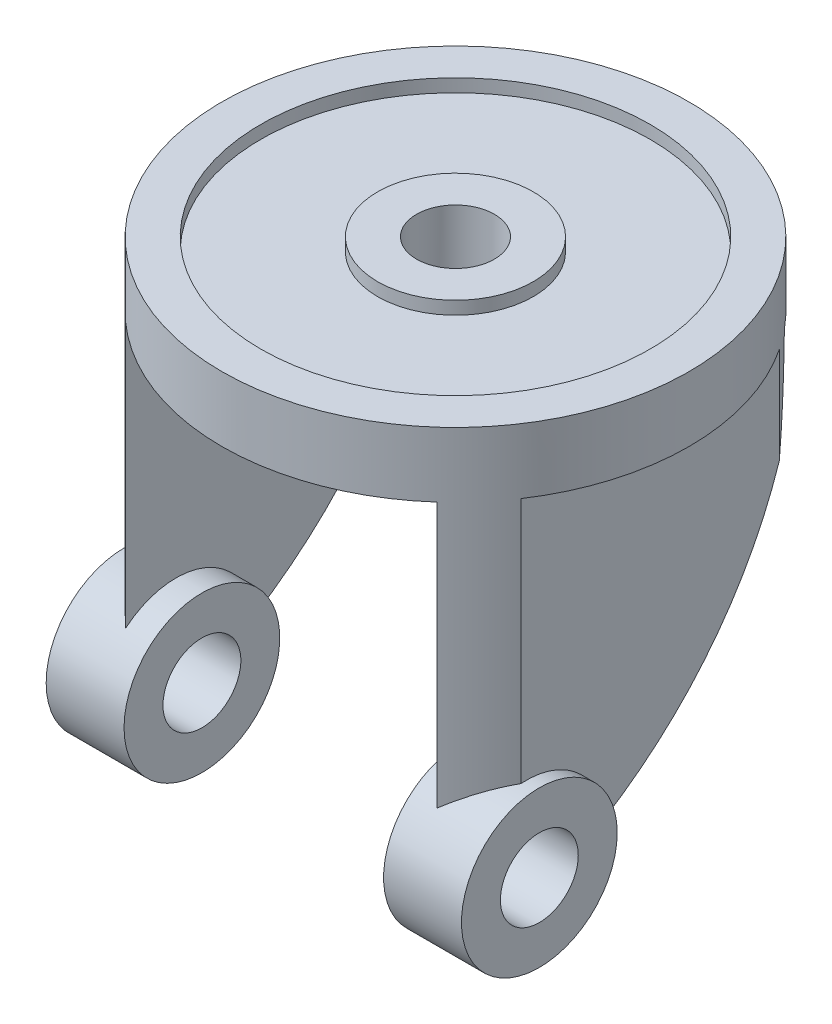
SolidWorks part; units mm, degrees
ref_plane "Front" through (0, 0, 0) normal (0, 0, 1) x (1, 0, 0)
ref_plane "Top" through (0, 0, 0) normal (0, 1, 0) x (1, 0, 0)
ref_plane "Right" through (0, 0, 0) normal (1, 0, 0) x (0, 0, -1)
sketch "Sketch1" plane through (0, 0, 0) normal (1, 0, 0) x (0, 0, -1)
  circle A0 centre (0, 0) radius 18
  circle A1 centre (0, 0) radius 9
  dimension "D1" = 18
  dimension "D2" = 36
extrude "Boss-Extrude1" add sketch "Sketch1" along normal mid plane 96
ref_plane "Plane1" through (0, 90, 0) normal (0, 1, 0) x (-1, 0, 0)
sketch "Sketch2" plane through (0, 90, 0) normal (0, 1, 0) x (-1, 0, 0)
  circle A0 centre (0, -28.6156) radius 54
  dimension "D1" = 108
extrude "Boss-Extrude2" add sketch "Sketch2" against normal blind 15 separate body
ref_plane "Plane2" through (45, 0, 0) normal (1, 0, 0) x (0, 0, -1)
sketch "Sketch3" plane through (45, 0, 0) normal (1, 0, 0) x (0, 0, -1)
  line L0 (-18, 0) -> (-18, 75)
  line L1 (-25.3844, 75) -> (82.6156, 75) construction
  line L2 (0, 0) -> (0, 75) construction
  line L3 (-18, 75) -> (30, 75)
  line L4 (30, 75) -> (63, 75)
  circle A0 centre (0, 0) radius 18 construction
  arc A1 (17.9555, 1.2643) -> (63, 75) centre (-32.6806, 82.8239) ccw
  arc A2 (17.9555, 1.2643) -> (-18, 0) centre (0, 0) ccw
  dimension "D3" = 192
  dimension "D1" = 30
  dimension "D2" = 33
extrude "Boss-Extrude3" add sketch "Sketch3" against normal blind 9
mirror "Mirror1" about plane through (0, 0, 0) normal (1, 0, 0) of "Boss-Extrude3"
sketch "Sketch4" plane through (0, 90, 0) normal (0, 1, 0) x (1, 0, 0)
  line L2 (-41.6379, 63) -> (-45, 63)
  line L3 (-45, 63) -> (-45, 58.4652)
  line L4 (-41.6379, 63) -> (-45, 63)
  line L5 (-45, 63) -> (-45, 58.4652)
  line L6 (45, 58.4652) -> (45, 63)
  line L7 (45, 63) -> (41.6379, 63)
  line L8 (45, 58.4652) -> (45, 63)
  line L9 (45, 63) -> (41.6379, 63)
  circle A0 centre (0, 28.6156) radius 54
  arc A2 (-41.6379, 63) -> (-45, 58.4652) centre (0, 28.6156) ccw
  arc A3 (-41.6379, 63) -> (-45, 58.4652) centre (0, 28.6156) ccw
  arc A4 (45, 58.4652) -> (41.6379, 63) centre (0, 28.6156) ccw
  arc A5 (45, 58.4652) -> (41.6379, 63) centre (0, 28.6156) ccw
  dimension "D1" = 108
  dimension "D2" = 0
  dimension "D3" = 0
extrude "Cut-Extrude1" cut sketch "Sketch4" against normal up to next contours L4 L5 M1 | L8 L9 M1
sketch "Sketch5" plane through (0, 75, 0) normal (0, 1, 0) x (1, 0, 0)
  line L3 (36, -11.6336) -> (36, -18)
  line L4 (36, -18) -> (45, -18)
  line L5 (45, -18) -> (45, -1.234)
  line L6 (36, -11.6336) -> (36, -18)
  line L7 (36, -18) -> (45, -18)
  line L8 (45, -18) -> (45, -1.234)
  line L9 (-45, -1.234) -> (-45, -18)
  line L10 (-45, -18) -> (-36, -18)
  line L11 (-36, -18) -> (-36, -11.6336)
  line L12 (-45, -1.234) -> (-45, -18)
  line L13 (-45, -18) -> (-36, -18)
  line L14 (-36, -18) -> (-36, -11.6336)
  arc A1 (36, -11.6336) -> (45, -1.234) centre (0, 28.6156) ccw
  arc A2 (36, -11.6336) -> (45, -1.234) centre (0, 28.6156) ccw
  arc A3 (-45, -1.234) -> (-36, -11.6336) centre (0, 28.6156) ccw
  arc A4 (-45, -1.234) -> (-36, -11.6336) centre (0, 28.6156) ccw
  dimension "D1" = 0
  dimension "D2" = 0
extrude "Cut-Extrude2" cut sketch "Sketch5" against normal up to surface (88.7353 mm away)
sketch "Sketch6" plane through (-45, 0, 0) normal (1, 0, 0) x (0, 0, -1)
  line L2 (-1.234, -17.9577) -> (-1.234, -8.915)
  line L3 (-1.234, 8.915) -> (-1.234, 17.9577)
  line L4 (-1.234, -17.9577) -> (-1.234, -8.915)
  line L5 (-1.234, 8.915) -> (-1.234, 17.9577)
  arc A2 (-1.234, 17.9577) -> (-1.234, -17.9577) centre (0, 0) ccw
  arc A3 (-1.234, 8.915) -> (-1.234, -8.915) centre (0, 0) ccw
  arc A4 (-1.234, 17.9577) -> (-1.234, -17.9577) centre (0, 0) ccw
  arc A5 (-1.234, 8.915) -> (-1.234, -8.915) centre (0, 0) ccw
  dimension "D1" = 0
extrude "Boss-Extrude4" add sketch "Sketch6" along normal up to next
sketch "Sketch7" plane through (45, 0, 0) normal (-1, 0, 0) x (0, 0, 1)
  line L2 (1.234, 17.9577) -> (1.234, 8.915)
  line L3 (1.234, -8.915) -> (1.234, -17.9577)
  line L4 (1.234, 17.9577) -> (1.234, 8.915)
  line L5 (1.234, -8.915) -> (1.234, -17.9577)
  arc A2 (1.234, -8.915) -> (1.234, 8.915) centre (0, 0) ccw
  arc A3 (1.234, -17.9577) -> (1.234, 17.9577) centre (0, 0) ccw
  arc A4 (1.234, -8.915) -> (1.234, 8.915) centre (0, 0) ccw
  arc A5 (1.234, -17.9577) -> (1.234, 17.9577) centre (0, 0) ccw
  dimension "D1" = 0
extrude "Boss-Extrude5" add sketch "Sketch7" along normal up to next
sketch "Sketch8" plane through (0, 0, 0) normal (0, 0, 1) x (1, 0, 0)
  line L1 (30, -35.3151) -> (-30, -35.3151)
  line L2 (30, -35.3151) -> (30, 35.3151)
  line L3 (30, 35.3151) -> (-30, 35.3151)
  line L4 (-30, -35.3151) -> (-30, 35.3151)
  line L5 (30, -35.3151) -> (-30, 35.3151) construction
  line L6 (30, 35.3151) -> (-30, -35.3151) construction
  point P0 (0, 0)
  dimension "D1" = 60
extrude "Cut-Extrude3" cut sketch "Sketch8" against normal mid plane 89
sketch "Sketch9" plane through (0, 90, 0) normal (0, 1, 0) x (1, 0, 0)
  circle A0 centre (0, 28.6156) radius 9
  dimension "D1" = 18
extrude "Cut-Extrude4" cut sketch "Sketch9" against normal blind 89
sketch "Sketch10" plane through (0, 90, 0) normal (0, 1, 0) x (1, 0, 0)
  circle A0 centre (0, 28.6156) radius 45
  circle A1 centre (0, 28.6156) radius 18
  dimension "D1" = 36
  dimension "D2" = 90
extrude "Cut-Extrude5" cut sketch "Sketch10" against normal blind 3
sketch "Sketch11" plane through (0, 75, 0) normal (0, -1, 0) x (1, 0, 0)
  circle A0 centre (0, -28.6156) radius 20
  dimension "D1" = 40
extrude "Cut-Extrude6" cut sketch "Sketch11" against normal blind 1.5
